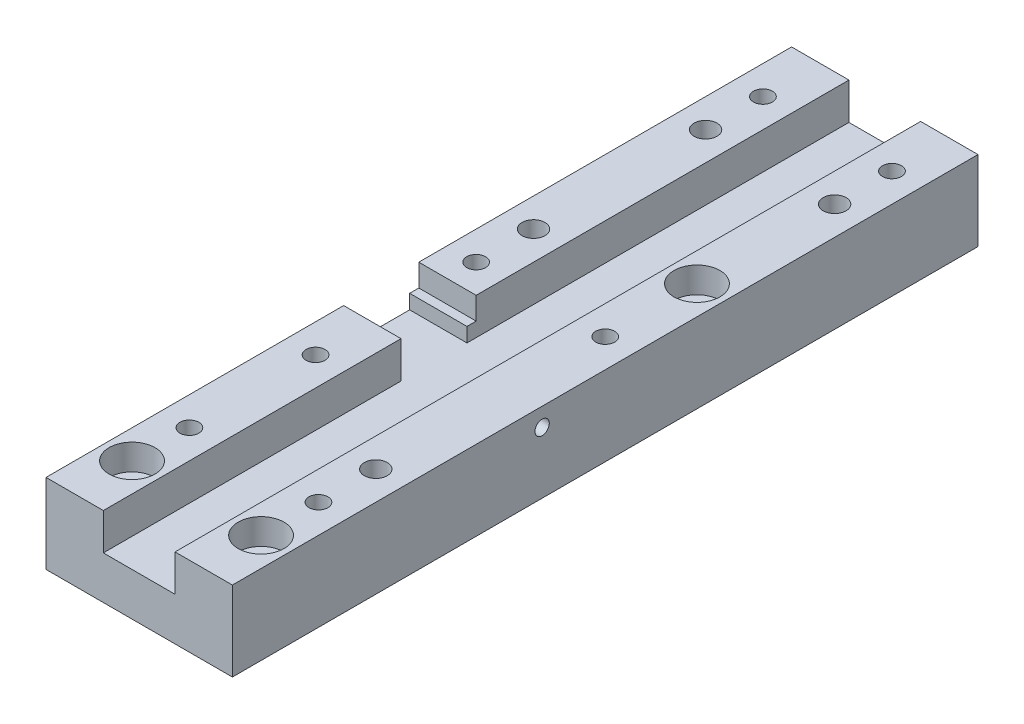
SolidWorks part; units mm, degrees
ref_plane "前视基准面" through (0, 0, 0) normal (0, 0, 1) x (1, 0, 0)
ref_plane "上视基准面" through (0, 0, 0) normal (0, 1, 0) x (1, 0, 0)
ref_plane "右视基准面" through (0, 0, 0) normal (1, 0, 0) x (0, 0, -1)
sketch "草图1" plane through (0, 0, 0) normal (0, 0, 1) x (1, 0, 0)
  line L0 (10, 7.5) -> (10, 13.9)
  line L1 (22.5, 7.5) -> (22.5, 13.9)
  line L2 (32.5, 0) -> (32.5, 13.9)
  line L3 (0, 0) -> (0, 13.9)
  line L4 (10, 7.5) -> (22.5, 7.5)
  line L5 (0, 13.9) -> (10, 13.9)
  line L6 (0, 0) -> (32.5, 0)
  line L7 (22.5, 13.9) -> (32.5, 13.9)
extrude "凸台-拉伸1" add sketch "草图1" along normal blind 130
sketch "草图2" plane through (32.5, 0, 0) normal (1, 0, 0) x (0, 0, -1)
  circle A0 centre (-76, 10.7) radius 1.25
extrude "切除-拉伸1" cut sketch "草图2" against normal blind 20
sketch "草图3" plane through (0, 13.9, 0) normal (0, 1, 0) x (1, 0, 0)
  circle A0 centre (27.5, -110) radius 1.65
  circle A1 centre (27.5, -60) radius 1.65
  circle A2 centre (27.5, -10) radius 1.65
  circle A3 centre (5, -10) radius 1.65
  circle A4 centre (5, -60) radius 1.65
  circle A5 centre (5, -88) radius 1.65
  circle A6 centre (5, -110) radius 1.65
  circle A7 centre (27.5, -20) radius 2
  circle A8 centre (27.5, -100) radius 2
  circle A9 centre (5, -50) radius 2
  circle A10 centre (5, -20) radius 2
  circle A11 centre (27.5, -44) radius 2.25
  circle A12 centre (27.5, -120) radius 2.25
  circle A13 centre (5, -120) radius 2.25
extrude "切除-拉伸2" cut sketch "草图3" against normal blind 20
sketch "草图4" plane through (0, 13.9, 0) normal (0, 1, 0) x (1, 0, 0)
  circle A0 centre (27.5, -44) radius 4
  circle A1 centre (27.5, -120) radius 4
  circle A2 centre (5, -120) radius 4
extrude "切除-拉伸3" cut sketch "草图4" against normal blind 4.5
sketch "草图5" plane through (0, 13.9, 0) normal (0, 1, 0) x (1, 0, 0)
  line L0 (0, -66.6) -> (10, -66.6)
  line L1 (0, -78.1) -> (10, -78.1)
  line L2 (0, -66.6) -> (0, -78.1)
  line L3 (10, -66.6) -> (10, -78.1)
extrude "切除-拉伸4" cut sketch "草图5" against normal up to surface (6.4 mm away)
sketch "草图6" plane through (0, 13.9, 0) normal (0, 1, 0) x (1, 0, 0)
  line L0 (0, -65) -> (10, -65)
  line L1 (0, -66.6) -> (10, -66.6)
  line L2 (0, -65) -> (0, -66.6)
  line L3 (10, -65) -> (10, -66.6)
extrude "切除-拉伸5" cut sketch "草图6" against normal blind 3.9
